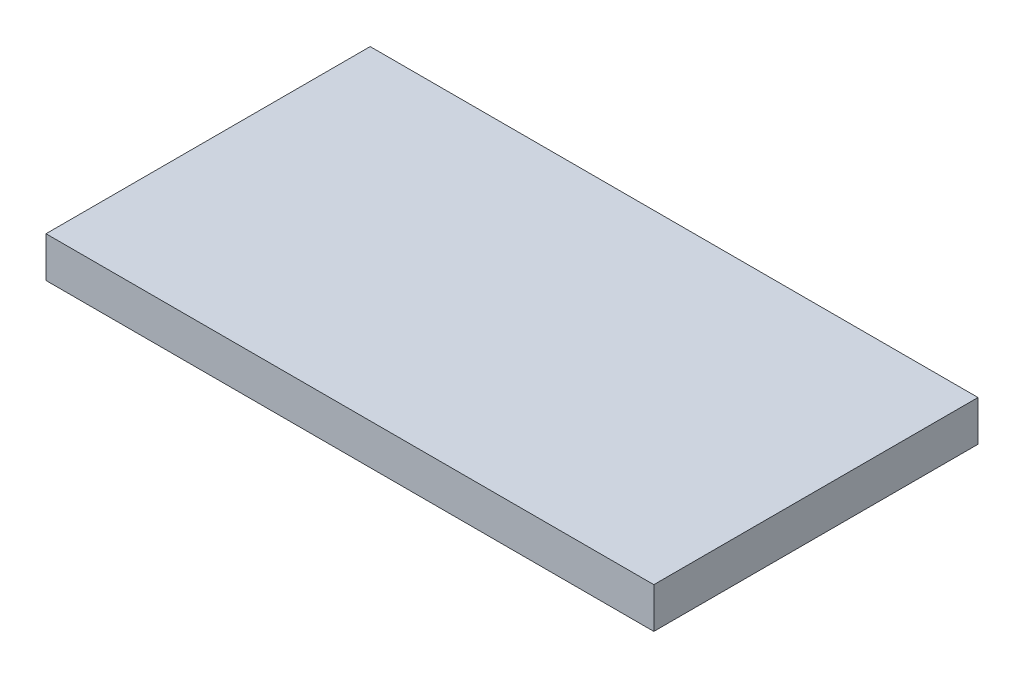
SolidWorks part; units mm, degrees
ref_plane "Front Plane" through (0, 0, 0) normal (0, 0, 1) x (1, 0, 0)
ref_plane "Top Plane" through (0, 0, 0) normal (0, 1, 0) x (1, 0, 0)
ref_plane "Right Plane" through (0, 0, 0) normal (1, 0, 0) x (0, 0, -1)
sketch "Sketch1" plane through (0, 0, 0) normal (0, 1, 0) x (1, 0, 0)
  line L1 (-75, -40) -> (75, -40)
  line L2 (-75, -40) -> (-75, 40)
  line L3 (-75, 40) -> (75, 40)
  line L4 (75, -40) -> (75, 40)
  line L5 (-75, -40) -> (75, 40) construction
  line L6 (-75, 40) -> (75, -40) construction
  point P0 (0, 0)
  dimension "D1" = 150
  dimension "D2" = 80
extrude "Boss-Extrude1" add sketch "Sketch1" along normal blind 10
